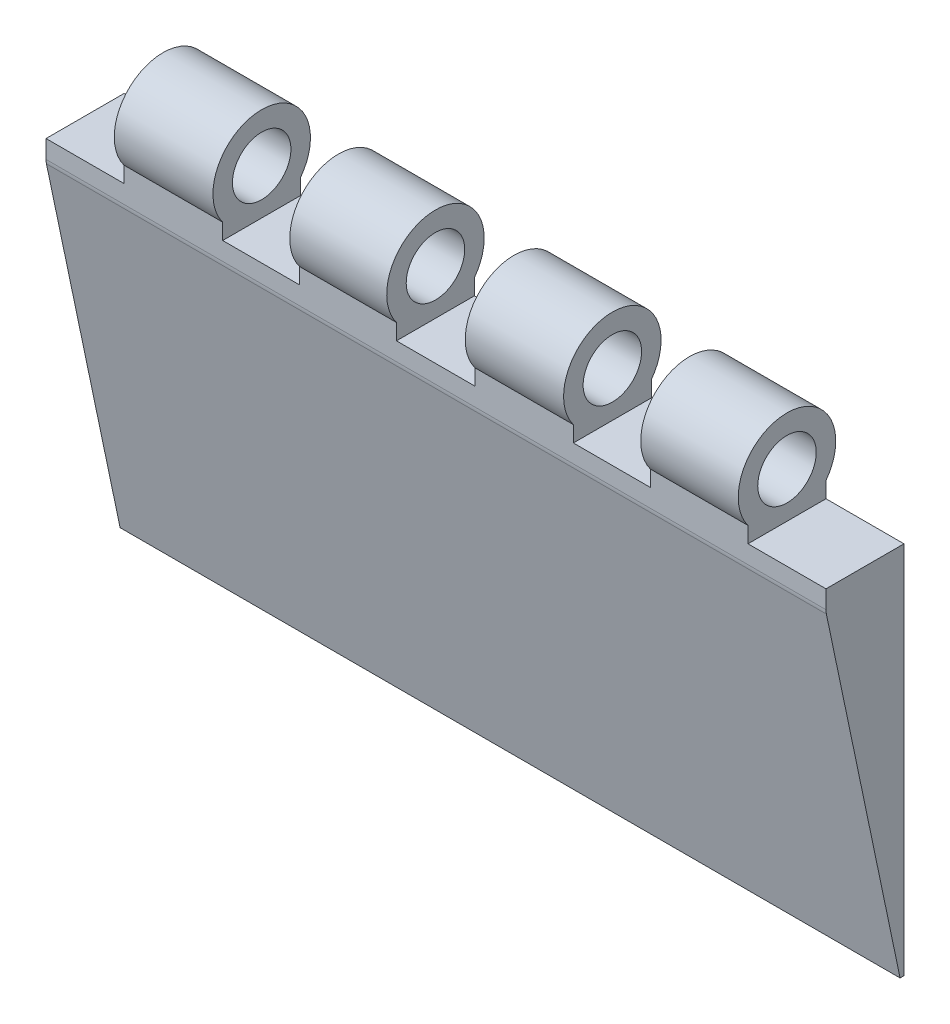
SolidWorks part; units mm, degrees
ref_plane "Front Plane" through (0, 0, 0) normal (0, 0, 1) x (1, 0, 0)
ref_plane "Top Plane" through (0, 0, 0) normal (0, 1, 0) x (1, 0, 0)
ref_plane "Right Plane" through (0, 0, 0) normal (1, 0, 0) x (0, 0, -1)
sketch "Sketch1" plane through (0, 0, 0) normal (1, 0, 0) x (0, 0, -1)
  line L1 (-2, 10) -> (2, 10)
  line L2 (-2, 10) -> (-2, -10)
  line L3 (-2, -10) -> (2, -10)
  line L4 (2, 10) -> (2, -10)
  line L5 (-2, 10) -> (2, -10) construction
  line L6 (-2, -10) -> (2, 10) construction
  point P0 (0, 0)
  dimension "D1" = 4
  dimension "D2" = 20
extrude "Boss-Extrude1" add sketch "Sketch1" along normal blind 40
sketch "Sketch2" plane through (0, 0, 0) normal (-1, 0, 0) x (0, 0, 1)
  circle A0 centre (0, 11.5) radius 2.5
  circle A1 centre (0, 11.5) radius 1.5
  point P2 (0, 0)
  dimension "D1" = 5
  dimension "D2" = 1
extrude "Boss-Extrude3" add sketch "Sketch2" against normal up to surface (40 mm away)
sketch "Sketch3" plane through (0, 0, -2) normal (0, 0, -1) x (-1, 0, 0)
  line L0 (-40, 14) -> (-40, 10) construction
  line L1 (-36, 16.4084) -> (-31, 16.4084)
  line L2 (-36, 16.4084) -> (-36, 9.185)
  line L3 (-36, 9.185) -> (-31, 9.185)
  line L4 (-31, 16.4084) -> (-31, 9.185)
  line L5 (-27, 16.4084) -> (-27, 9.185)
  line L6 (-27, 16.4084) -> (-22, 16.4084)
  line L7 (-22, 16.4084) -> (-22, 9.185)
  line L8 (-27, 9.185) -> (-22, 9.185)
  line L9 (-18, 16.4084) -> (-18, 9.185)
  line L10 (-18, 16.4084) -> (-13, 16.4084)
  line L11 (-13, 16.4084) -> (-13, 9.185)
  line L12 (-18, 9.185) -> (-13, 9.185)
  line L13 (-9, 16.4084) -> (-9, 9.185)
  line L14 (-9, 16.4084) -> (-4, 16.4084)
  line L15 (-4, 16.4084) -> (-4, 9.185)
  line L16 (-9, 9.185) -> (-4, 9.185)
  dimension "D1" = 4
  dimension "D2" = 5
  dimension "D3" = 4
sketch "Sketch4" plane through (0, 0, 0) normal (-1, 0, 0) x (0, 0, 1)
  line L0 (2, 8.1532) -> (-1.8, -10)
  line L1 (-1.8, -10) -> (5.1491, -10)
  line L2 (5.1491, -10) -> (4.6933, 8.1532)
  line L3 (4.6933, 8.1532) -> (2, 8.1532)
  line L4 (2, 10) -> (2, -10) construction
  line L5 (2, -10) -> (-2, -10) construction
  point P4 (0, 0)
  point P7 (0, 0)
  dimension "D1" = 0.2
extrude "Cut-Extrude2" cut sketch "Sketch4" against normal through all
fillet "Fillet1" radius 1 1 edges at (20, 8.1532, 2)
sketch "Sketch5" plane through (0, 0, 2) normal (0, 0, 1) x (1, 0, 0)
  line L1 (4, 9.185) -> (-2.253, 9.185)
  line L2 (4, 9.185) -> (4, 17.586)
  line L3 (4, 17.586) -> (-2.253, 17.586)
  line L4 (-2.253, 9.185) -> (-2.253, 17.586)
  line L5 (13, 9.185) -> (9.0603, 9.185)
  line L6 (13, 9.185) -> (13, 18.2263)
  line L7 (13, 18.2263) -> (9.0603, 18.2263)
  line L8 (9.0603, 9.185) -> (9.0603, 18.2263)
  line L9 (22, 9.185) -> (17.9721, 9.185)
  line L10 (22, 9.185) -> (22, 18.2263)
  line L11 (22, 18.2263) -> (17.9721, 18.2263)
  line L12 (17.9721, 9.185) -> (17.9721, 18.2263)
  line L13 (31, 9.185) -> (27.0441, 9.185)
  line L14 (31, 9.185) -> (31, 18.9201)
  line L15 (31, 18.9201) -> (27.0441, 18.9201)
  line L16 (27.0441, 9.185) -> (27.0441, 18.9201)
  line L17 (36, 9.185) -> (40.6521, 9.185)
  line L18 (36, 9.185) -> (36, 17.586)
  line L19 (36, 17.586) -> (40.6521, 17.586)
  line L20 (40.6521, 9.185) -> (40.6521, 17.586)
extrude "Cut-Extrude3" cut sketch "Sketch5" against normal through all both and the other way through all
